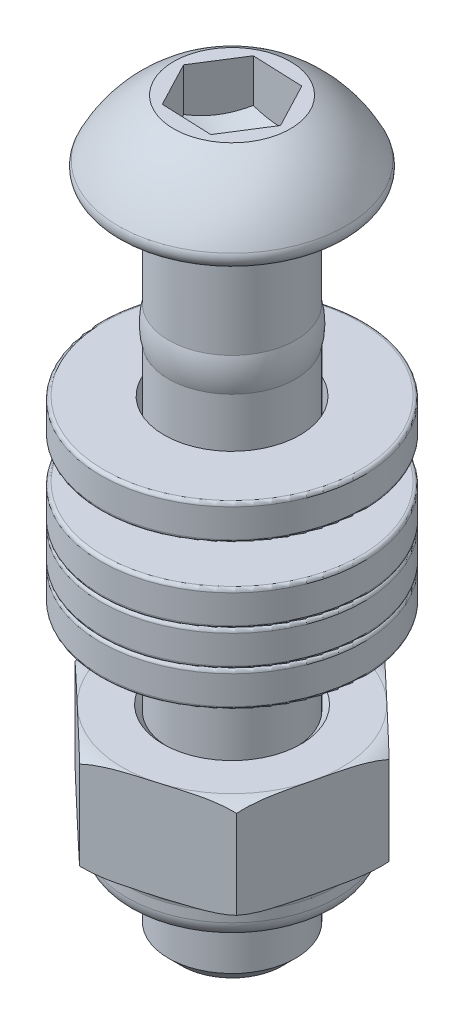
SolidWorks part; units mm, degrees
ref_plane "Plan de face" through (0, 0, 0) normal (0, 0, 1) x (1, 0, 0)
ref_plane "Plan de dessus" through (0, 0, 0) normal (0, 1, 0) x (1, 0, 0)
ref_plane "Plan de droite" through (0, 0, 0) normal (1, 0, 0) x (0, 0, -1)
sketch "Esquisse1" plane through (0, 0, 0) normal (0, 0, 1) x (1, 0, 0)
  line L0 (0, 0) -> (0, -30)
  line L1 (0, -30) -> (-2.3, -30)
  line L2 (-2.3, -30) -> (-2.9, -29.4)
  line L3 (-2.9, -29.4) -> (-2.9, 0)
  line L4 (-2.5, 3.3) -> (-2.6658, 3.3)
  line L6 (-2.5, 3.3) -> (-2.5, 1.4434)
  line L7 (-2.5, 1.4434) -> (0, 0)
  line L8 (-4.75, 0) -> (-2.9, 0)
  arc A0 (-2.6658, 3.3) -> (-5.1981, 0.7218) centre (0, -1.8511) ccw
  arc A1 (-5.1981, 0.7218) -> (-4.75, 0) centre (-4.75, 0.5) ccw
  dimension "D5" = 3.3
  dimension "D7" = 5.8
  dimension "D3" = 0.5
  dimension "D1" = 60
  dimension "D2" = 2.9
  dimension "D4" = 2.5
  dimension "D6" = 4.75
  dimension "D8" = 45
  dimension "D9" = 0.6
  dimension "D10" = 3.3
  dimension "D11" = 30
revolve "Révolution1" add sketch "Esquisse1" angle 360 about L0
sketch "Esquisse2" plane through (0, 3.3, 0) normal (0, 1, 0) x (1, 0, 0)
  line L1 (-1.0737, 2.0446) -> (-2.3075, 0.0925)
  line L2 (-2.3075, 0.0925) -> (-1.2339, -1.9521)
  line L3 (-1.2339, -1.9521) -> (1.0737, -2.0446)
  line L4 (1.0737, -2.0446) -> (2.3075, -0.0925)
  line L5 (2.3075, -0.0925) -> (1.2339, 1.9521)
  line L6 (1.2339, 1.9521) -> (-1.0737, 2.0446)
  circle A0 centre (0, 0) radius 2 construction
  circle A1 centre (0, 0) radius 2.6658 construction
  circle A2 centre (0, 0) radius 2.6658
  dimension "D2" = 4
extrude "Boss.-Extru.1" add sketch "Esquisse2" against normal up to surface (3.3 mm away)
sketch "Esquisse4" plane through (0, 0, 0) normal (0, 0, 1) x (1, 0, 0)
  line L0 (0, 0) -> (0, -18.2878) construction
  line L1 (3.1, -15.2) -> (5.85, -15.2)
  line L2 (3.1, -15.2) -> (3.1, -16.8)
  line L3 (3.1, -16.8) -> (5.85, -16.8)
  line L4 (6, -15.35) -> (6, -16.65)
  arc A0 (5.85, -16.8) -> (6, -16.65) centre (5.85, -16.65) ccw
  arc A1 (5.85, -15.2) -> (6, -15.35) centre (5.85, -15.35) cw
  dimension "D4" = 0.15
  dimension "D1" = 3.1
  dimension "D2" = 1.6
  dimension "D3" = 6
  dimension "D5" = 15.2
revolve "Révolution2" add sketch "Esquisse4" angle 360 about L0
sketch "Esquisse3" plane through (0, 0, 0) normal (0, 0, 1) x (1, 0, 0)
  line L0 (2.9, -29.4) -> (2.9, 0) construction
  line L1 (3.15, -20.8) -> (5, -20.8)
  line L2 (2.9, -21.05) -> (2.9, -26.6)
  line L3 (0, 0) -> (0, -17.1274) construction
  line L4 (5, -20.8) -> (5, -25.3) construction
  line L5 (3.65, -26.8) -> (3.65, -26.6)
  line L6 (2.9, -21.05) -> (3.15, -20.8)
  line L7 (4.8, -25.597) -> (4.8, -26.05)
  line L8 (4.05, -26.8) -> (3.65, -26.8)
  line L10 (3.65, -26.6) -> (2.9, -26.6)
  line L11 (6.75, -23.05) -> (5, -23.05) construction
  line L12 (5, -23.05) -> (3.25, -23.05) construction
  line L13 (-5.85, -16.8) -> (5.85, -16.8) construction
  arc A0 (4.8, -25.597) -> (5.082, -25.2975) centre (5.1, -25.597) cw
  arc A1 (4.8, -26.05) -> (4.05, -26.8) centre (4.05, -26.05) cw
  ellipse E0 centre (5, -23.05) end of major axis (5, -20.8) minor radius 1.75 (5.082, -25.2975) -> (5, -20.8) ccw
  point P0 (2.9, -20.8)
  point P15 (4.8, -26.8)
  dimension "D6" = 0.75
  dimension "D7" = 1.9
  dimension "D8" = 0.3
  dimension "D1" = 4.5
  dimension "D2" = 6
  dimension "D3" = 5
  dimension "D4" = 5.8
  dimension "D5" = 0.75
  dimension "D10" = 1.75
  dimension "D11" = 4
revolve "Révolution3" add sketch "Esquisse3" angle 360 about L3
sketch "Esquisse5" plane through (0, -15.2, 0) normal (0, 1, 0) x (1, 0, 0)
  line L1 (-5.5357, -1.6398) -> (-1.3478, -5.614)
  line L2 (-1.3478, -5.614) -> (4.188, -3.9742)
  line L3 (4.188, -3.9742) -> (5.5357, 1.6398)
  line L4 (5.5357, 1.6398) -> (1.3478, 5.614)
  line L5 (1.3478, 5.614) -> (-4.188, 3.9742)
  line L6 (-4.188, 3.9742) -> (-5.5357, -1.6398)
  circle A0 centre (0, 0) radius 5 construction
  circle A1 centre (0, 0) radius 9.7979
  dimension "D1" = 10
extrude "Enlèv. mat.-Extru.1" cut sketch "Esquisse5" against normal blind 50
pattern_linear "Répétition linéaire1" count 2 spacing 6.6 along (0, 1, 0)
fillet "Congé1" radius 0.5 1 edges at (0, -26.8, 3.65)
pattern_linear "Répétition linéaire3" count 3 spacing 1.6 along (0, 1, 0)
sketch "Esquisse7" plane through (0, 0, 0) normal (1, 0, 0) x (0, 0, -1)
  line L0 (0, 0) -> (0, -11.434) construction
  point P3 (0, -5.717)
  point P4 (0, 0)
ref_plane "Plan1" through (0, -5.717, 0) normal (0, 1, 0) x (-1, 0, 0)
sketch "Esquisse8" plane through (0, -5.717, 0) normal (0, 1, 0) x (-1, 0, 0)
  line L0 (0, 3) -> (0, -3)
  arc A0 (0, 3) -> (0, -3) centre (0, 0) ccw
revolve "Révolution8" add sketch "Esquisse8" angle 360 about L0
